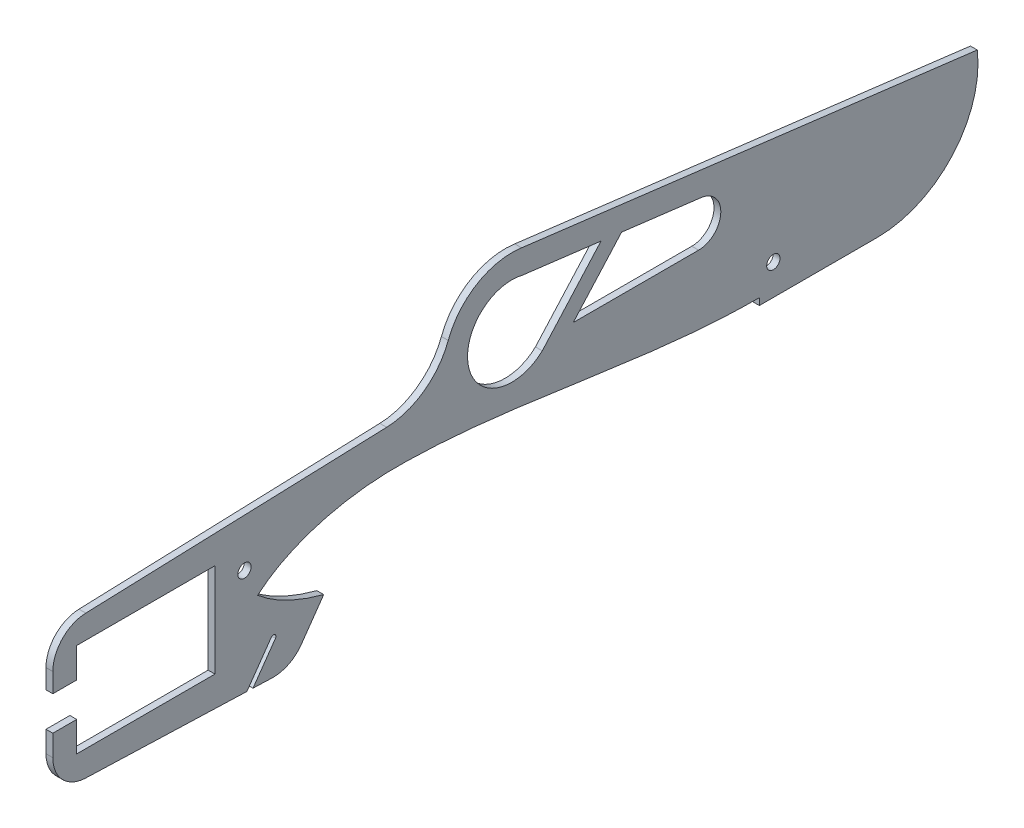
SolidWorks part; units mm, degrees
ref_plane "Plan de face" through (0, 0, 0) normal (0, 0, 1) x (1, 0, 0)
ref_plane "Plan de dessus" through (0, 0, 0) normal (0, 1, 0) x (1, 0, 0)
ref_plane "Plan de droite" through (0, 0, 0) normal (1, 0, 0) x (0, 0, -1)
sketch "Esquisse1" plane through (0, 0, 0) normal (1, 0, 0) x (0, 0, -1)
  line L0 (-79.0921, 0) -> (468.674, 0) construction
  line L1 (0, -28.3155) -> (0, 75.1731) construction
  line L2 (9.6816, -28.3155) -> (9.6816, 75.1731) construction
  line L3 (19.3632, -28.3155) -> (19.3632, 75.1731) construction
  line L4 (29.0448, -28.3155) -> (29.0448, 75.1731) construction
  line L5 (38.7264, -28.3155) -> (38.7264, 75.1731) construction
  line L6 (48.408, -28.3155) -> (48.408, 75.1731) construction
  line L7 (58.0895, -28.3155) -> (58.0895, 75.1731) construction
  line L8 (67.7711, -28.3155) -> (67.7711, 75.1731) construction
  line L9 (77.4527, -28.3155) -> (77.4527, 75.1731) construction
  line L10 (87.1343, -28.3155) -> (87.1343, 75.1731) construction
  line L11 (96.8159, -28.3155) -> (96.8159, 75.1731) construction
  line L12 (106.4975, -28.3155) -> (106.4975, 75.1731) construction
  line L13 (116.1791, -28.3155) -> (116.1791, 75.1731) construction
  line L14 (125.8607, -28.3155) -> (125.8607, 75.1731) construction
  line L15 (135.5423, -28.3155) -> (135.5423, 75.1731) construction
  line L16 (132.3708, 2) -> (149.2906, 2) construction
  line L17 (7.1453, 6) -> (11.5459, 6) construction
  line L18 (18.0174, 10) -> (22.1592, 10) construction
  line L19 (28.8895, 11.5) -> (33.4196, 11.5) construction
  line L20 (38.079, 12.2) -> (41.0559, 12.2) construction
  line L21 (47.7863, 11.5) -> (51.7986, 11.5) construction
  line L22 (58.6584, 11) -> (61.5059, 11) construction
  line L23 (68.3657, 10) -> (70.9543, 10) construction
  line L24 (76.7786, 9) -> (81.4381, 9) construction
  line L25 (86.7447, 7.5) -> (91.5337, 7.5) construction
  line L26 (98.0052, 6) -> (101.3703, 6) construction
  line L27 (107.0653, 4.7) -> (111.4659, 4.7) construction
  line L28 (117.4197, 4) -> (121.432, 4) construction
  line L29 (127.1269, 3) -> (131.0098, 3) construction
  line L30 (147, 20.3151) -> (147, -36.2431) construction
  line L31 (-60, -34.5527) -> (-60, 97.3704) construction
  line L32 (25.8302, 24) -> (38.079, 24) construction
  line L33 (-79.0921, 20.5) -> (-63.6349, 20.5) construction
  line L34 (-50.3479, 20.6462) -> (37.7981, 23.7145)
  line L41 (181.5916, 0) -> (147, 0)
  line L42 (-50.3479, -21.2031) -> (4.2664, -23.1042)
  line L43 (210.8456, 32.9306) -> (77.3318, 49.4859)
  line L44 (83.392, 20.3151) -> (100.5902, 39.5578)
  line L51 (147, 0) -> (147, 2)
  line L52 (12.7966, -18.8591) -> (19.3632, -9.5129)
  line L53 (-60, 10.6522) -> (-60, 5)
  line L54 (-81.1724, 5) -> (-63.0165, 5) construction
  line L55 (-53, 33.2498) -> (-53, -28.3155) construction
  line L56 (-12.5, 33.2498) -> (-12.5, -28.3155) construction
  line L57 (-82.6543, 13.75) -> (-22.9644, 13.75) construction
  line L58 (-82.6543, -13.75) -> (-22.9644, -13.75) construction
  line L59 (-60, 5) -> (-53, 5)
  line L60 (-53, 13.75) -> (-12.5, 13.75)
  line L61 (-53, 13.75) -> (-53, 5)
  line L62 (-53, -13.75) -> (-12.5, -13.75)
  line L63 (-12.5, 13.75) -> (-12.5, -13.75)
  line L64 (-60, -5) -> (-53, -5)
  line L65 (-53, -5) -> (-53, -13.75)
  line L66 (-60, -5) -> (-60, -11.2092)
  line L67 (116.1791, 36.5299) -> (77.4527, 9.3354) construction
  line L68 (106.6271, 38.8093) -> (92.4605, 22.9584)
  line L70 (130.0034, 35.9107) -> (106.6271, 38.8093)
  line L71 (92.4605, 22.9584) -> (129.2034, 22.9584)
  line L72 (100.5902, 39.5578) -> (77.67, 42.3998)
  arc A0 (-50.3479, 20.6462) -> (-60, 10.6522) centre (-50, 10.6522) ccw
  arc A1 (-50.3479, -21.2031) -> (-60, -11.2092) centre (-50, -11.2092) cw
  arc A2 (12.7966, -18.8591) -> (4.2664, -23.1042) centre (4.6143, -13.1103) cw
  arc A3 (77.3318, 49.4859) -> (55.8476, 36.7298) centre (74.4949, 29.7935) ccw
  arc A4 (77.67, 42.3998) -> (83.392, 20.3151) centre (74.4949, 29.7935) ccw
  circle A5 centre (-3.8552, 8.1877) radius 1.95
  circle A6 centre (151.0899, 9) radius 1.95
  arc A8 (129.2034, 22.9584) -> (130.0034, 35.9107) centre (129.2034, 29.4593) ccw
  arc A9 (37.7981, 23.7145) -> (55.8476, 36.7298) centre (37.1024, 43.7024) ccw
  arc A10 (181.5916, 0) -> (210.8456, 32.9306) centre (181.5916, 29.4593) ccw
  spline S0 degree 3 poles (0, 0) (10.0229, 8.6747) (26.5039, 12.1434) (52.9502, 12.2543) (89.3382, 8.3498) (124.8789, 2.0117) (147, 2) knots 0 0 0 0 0.28008 0.28008 0.548832 1 1 1 1
  spline S1 degree 3 poles (0, 0) (5.1687, -4.4734) (12.0547, -7.5624) (19.3632, -9.5129) knots 0 0 0 0 0.144432 0.144432 0.144432 0.144432
  point P110 (-60, 20.3102)
  point P116 (9.6816, -23.2927)
  dimension "D16" = 10
  dimension "D17" = 5
  dimension "D6" = 5
  dimension "D1" = 147
  dimension "D2" = 60
  dimension "D3" = 20.5
  dimension "D4" = 24
  dimension "D12" = 40.5
  dimension "D13" = 27.5
  dimension "D14" = 13.75
  dimension "D15" = 7
extrude "Extrusion1" add sketch "Esquisse1" along normal blind 2
sketch "Esquisse2" plane through (0, 0, 0) normal (-1, 0, 0) x (0, 0, 1)
  line L0 (-13.9436, 0.1681) -> (3.3263, -24.4121) construction
  line L1 (-12.7966, -18.8591) -> (-19.3632, -9.5129) construction
  line L2 (-12.7966, -18.8591) -> (-1.4584, -10.893) construction
  line L3 (-5.4135, -10.6681) -> (4.279, -24.4634) construction
  line L4 (-6.6236, -11.555) -> (3.069, -25.3504) construction
  line L5 (-4.0006, -12.6791) -> (3.3263, -23.1075)
  line L6 (3.3263, -23.1075) -> (2.099, -23.9698)
  line L7 (2.099, -23.9698) -> (-5.2279, -13.5414)
  arc A0 (-4.0006, -12.6791) -> (-5.2279, -13.5414) centre (-4.6143, -13.1103) ccw
  dimension "D2" = 0.75
  dimension "D1" = 10
  dimension "D3" = 1.5
extrude "Enlèv. mat.-Extru.1" cut sketch "Esquisse2" against normal blind 2
